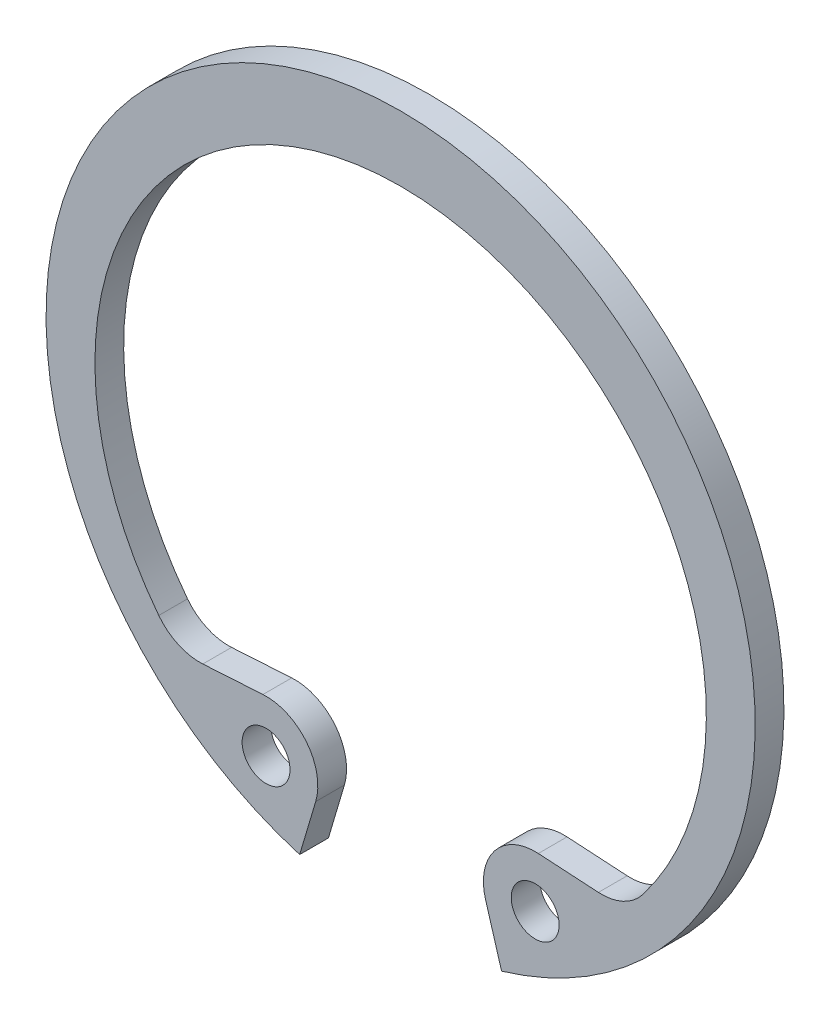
SolidWorks part; units mm, degrees
ref_plane "Face" through (0, 0, 0) normal (0, 0, 1) x (1, 0, 0)
ref_plane "Dessus" through (0, 0, 0) normal (0, 1, 0) x (1, 0, 0)
ref_plane "Droite" through (0, 0, 0) normal (1, 0, 0) x (0, 0, -1)
sketch "Esquisse1" plane through (0, 0, 0) normal (0, 0, 1) x (1, 0, 0)
  line L0 (0, 15.1) -> (0, 18.5) construction
  line L1 (4.432, -14.9234) -> (5.2668, -17.7344)
  line L2 (5.8206, -11.7359) -> (8.2199, -16.5736) construction
  line L3 (10.3197, -11.6492) -> (7.1832, -11.4596)
  line L4 (-10.3197, -11.6492) -> (-7.1832, -11.4596)
  line L5 (-4.432, -14.9234) -> (-5.2668, -17.7344)
  line L6 (5.4612, -15.0046) -> (6.4642, -17.7602) construction
  line L7 (-5.4612, -15.0046) -> (-6.4642, -17.7602) construction
  arc A0 (5.2668, -17.7344) -> (-5.2668, -17.7344) centre (0, 0) ccw
  arc A1 (12.6187, -10.6056) -> (-12.6187, -10.6056) centre (0, -0.85) ccw
  arc A2 (7.1832, -11.4596) -> (4.432, -14.9234) centre (7.0203, -14.1547) ccw
  arc A3 (10.3197, -11.6492) -> (12.6187, -10.6056) centre (10.4826, -8.9542) ccw
  circle A4 centre (7.0203, -14.1547) radius 1.25
  arc A5 (-10.3197, -11.6492) -> (-12.6187, -10.6056) centre (-10.4826, -8.9542) cw
  circle A6 centre (-7.0203, -14.1547) radius 1.25
  arc A7 (-7.1832, -11.4596) -> (-4.432, -14.9234) centre (-7.0203, -14.1547) cw
  arc A8 (6.4642, -17.7602) -> (-6.4642, -17.7602) centre (0, 0) ccw construction
  circle A9 centre (0, 0) radius 17.5 construction
  dimension "dgorge" = 37
  dimension "D3" = 0.85
  dimension "dtrou" = 2.5
  dimension "dext" = 37.8
  dimension "dn" = 35
  dimension "b" = 3.4
  dimension "a" = 5.4
  dimension "D5" = 70
  dimension "D7" = 33.081
  dimension "D9" = 40
extrude "Base-Extrusion" add sketch "Esquisse1" along normal blind 1.5
equation "\"D3@Esquisse1\" = \"b@Esquisse1\"/4"
equation "\"D7@Esquisse1\" = 360-(360-\"D9@Esquisse1\")*\"dext@Esquisse1\"/\"dgorge@Esquisse1\""
